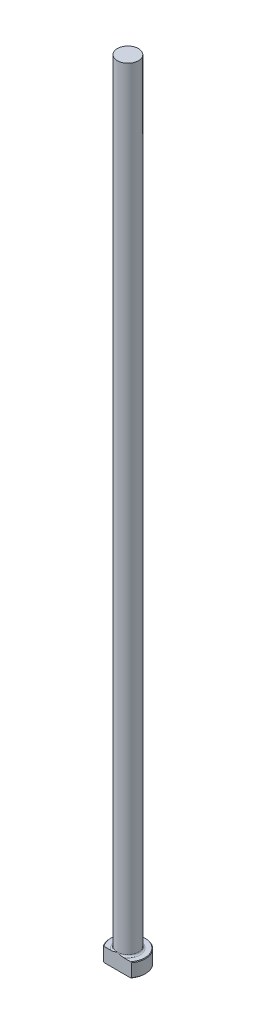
SolidWorks part; units mm, degrees
ref_plane "Front Plane" through (0, 0, 0) normal (0, 0, 1) x (1, 0, 0)
ref_plane "Top Plane" through (0, 0, 0) normal (0, 1, 0) x (1, 0, 0)
ref_plane "Right Plane" through (0, 0, 0) normal (1, 0, 0) x (0, 0, -1)
sketch "Sketch1" plane through (0, 0, 0) normal (0, 0, 1) x (1, 0, 0)
  line L0 (0, 259.9588) -> (0, -15.1925) construction
  line L1 (0, 0) -> (-7.9375, 0)
  line L2 (-7.9375, 0) -> (-7.9375, 6.35)
  line L3 (-7.9375, 6.35) -> (-4.7625, 6.35)
  line L4 (-4.7625, 6.35) -> (-4.7625, 355.6)
  line L5 (-4.7625, 355.6) -> (0, 355.6)
  line L6 (0, 355.6) -> (0, 0)
  dimension "L" = 355.6
  dimension "H" = 15.875
  dimension "T" = 6.35
  dimension "D" = 9.525
revolve "Revolve1" add sketch "Sketch1" angle 360 about L0
chamfer "Chamfer1" distance 0.254 angle 45 2 edges at (0, 6.35, 7.9375) (0, 0, 7.9375)
fillet "Fillet1" radius 0.762 1 edges at (0, 6.35, 4.7625)
sketch "Sketch2" plane through (0, 0, 0) normal (0, 1, 0) x (1, 0, 0)
  line L0 (-6.35, -4.7625) -> (6.35, -4.7625)
  circle A0 centre (0, 0) radius 7.9375 construction
  arc A1 (-6.35, -4.7625) -> (6.35, -4.7625) centre (0, 0) ccw
  circle A3 centre (0, 0) radius 4.7625 construction
  dimension "D1" = 0
extrude "Key" cut sketch "Sketch2" along normal through all
sketch "Pocket Sketch" plane through (0, 0, 0) normal (0, 0, 1) x (1, 0, 0)
  line L0 (-8.3344, 0) -> (-8.3344, 6.3754)
  line L1 (-8.3344, 6.3754) -> (-5.9214, 6.3754)
  line L2 (-5.1594, 7.1374) -> (-5.1594, 22.225)
  line L3 (-5.1594, 22.225) -> (0, 22.225)
  line L4 (0, 22.225) -> (0, 0)
  line L5 (0, 0) -> (-8.3344, 0)
  line L6 (0, 12.6104) -> (0, -2.4989) construction
  line L7 (-7.9375, 6.096) -> (-7.9375, 0.254) construction
  line L8 (7.6835, 6.35) -> (-7.6835, 6.35) construction
  line L9 (-4.7625, 355.6) -> (-4.7625, 7.112) construction
  line L10 (-5.9214, 6.3754) -> (-5.1594, 7.1374)
  point P3 (-5.1594, 6.3754)
  dimension "D1" = 16.6687
  dimension "D2" = 0.3969
  dimension "D3" = 0.0254
  dimension "D4" = 0.3969
  dimension "D5" = 10.3187
  dimension "D6" = 22.225
